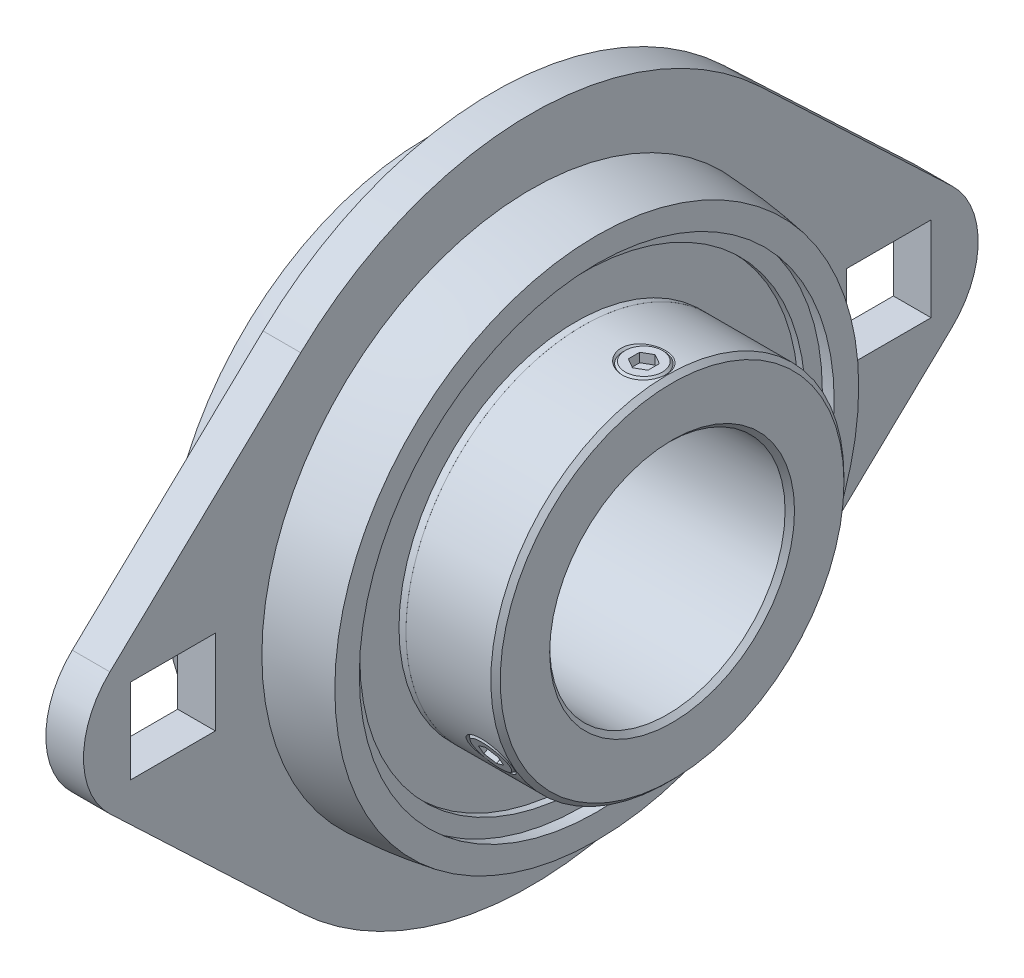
SolidWorks part; units mm, degrees
ref_plane "Front" through (0, 0, 0) normal (0, 0, 1) x (1, 0, 0)
ref_plane "Top" through (0, 0, 0) normal (0, 1, 0) x (1, 0, 0)
ref_plane "Right" through (0, 0, 0) normal (1, 0, 0) x (0, 0, -1)
imported_body "Imported1"
sketch "Sketch1" plane through (19.5, 0, 0) normal (1, 0, 0) x (0, 0, -1)
  circle A0 centre (0, 0) radius 18.75
extrude "Cut-Extrude1" cut sketch "Sketch1" against normal blind 2.5
chamfer "Chamfer1" distance 0.5 angle 45 2 edges at (17, 0, -12.5) (17, 0, -18.75)
